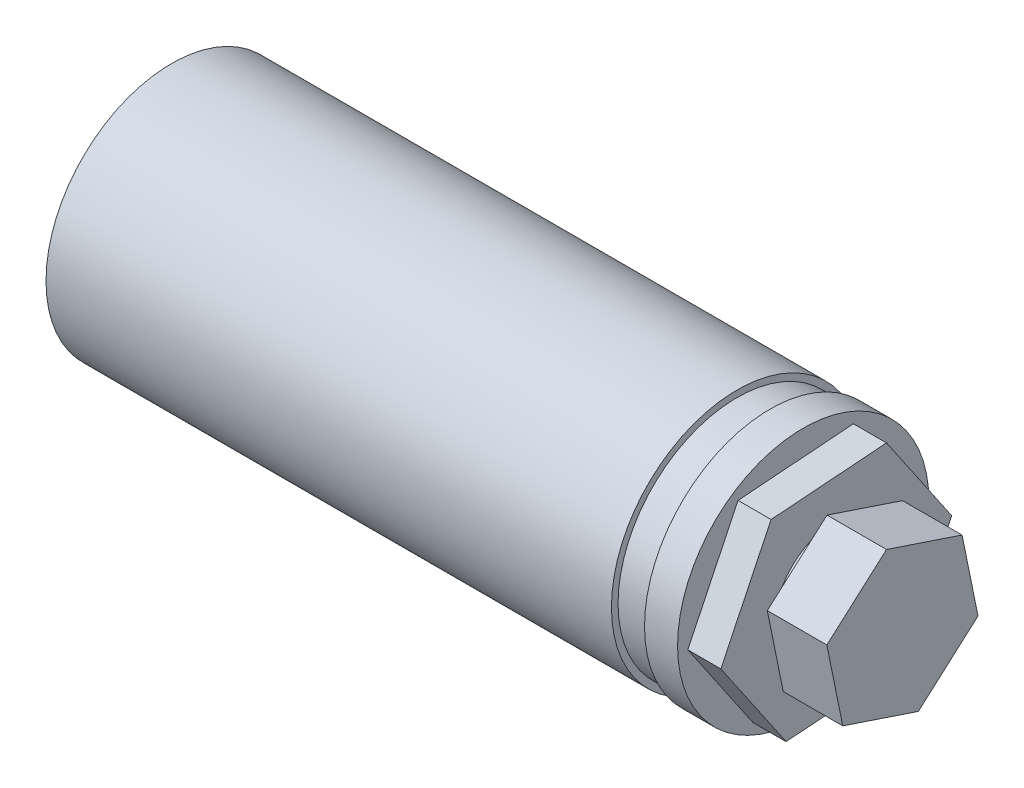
SolidWorks part; units mm, degrees
ref_plane "Alzado" through (0, 0, 0) normal (0, 0, 1) x (1, 0, 0)
ref_plane "Planta" through (0, 0, 0) normal (0, 1, 0) x (1, 0, 0)
ref_plane "Vista lateral" through (0, 0, 0) normal (1, 0, 0) x (0, 0, -1)
sketch "Croquis1" plane through (0, 0, 0) normal (0, 0, 1) x (1, 0, 0)
  line L0 (0, 0) -> (33.7038, 0) construction
  line L1 (0, 0) -> (0, 19)
  line L2 (0, 19) -> (85.5, 19)
  line L3 (85.5, 19) -> (85.5, 18)
  line L4 (85.5, 18) -> (90.5, 18)
  line L5 (90.5, 18) -> (90.5, 19)
  line L6 (90.5, 19) -> (95.5, 19)
  line L7 (95.5, 19) -> (95.5, 0)
  line L8 (95.5, 0) -> (0, 0)
  dimension "D1" = 38
  dimension "D2" = 1
  dimension "D3" = 85.5
  dimension "D4" = 5
revolve "Revolución1" add sketch "Croquis1" angle 360 about L0
sketch "Croquis2" plane through (95.5, 0, 0) normal (1, 0, 0) x (0, 0, -1)
  line L7 (-9.859, 14.4586) -> (-17.451, -1.3089)
  line L8 (-17.451, -1.3089) -> (-7.592, -15.7674)
  line L9 (-7.592, -15.7674) -> (9.859, -14.4586)
  line L10 (9.859, -14.4586) -> (17.451, 1.3089)
  line L11 (17.451, 1.3089) -> (7.592, 15.7674)
  line L12 (7.592, 15.7674) -> (-9.859, 14.4586)
  circle A0 centre (0, 0) radius 15.1554 construction
  dimension "D1" = 35
extrude "Saliente-Extruir1" add sketch "Croquis2" along normal blind 5
sketch "Croquis3" plane through (100.5, 0, 0) normal (1, 0, 0) x (0, 0, -1)
  circle A0 centre (0, 0) radius 9.5
  dimension "D1" = 19
extrude "Saliente-Extruir2" add sketch "Croquis3" along normal blind 1
sketch "Croquis4" plane through (101.5, 0, 0) normal (1, 0, 0) x (0, 0, -1)
  line L1 (-2.407, 11.8071) -> (-11.4288, 3.819)
  line L2 (-11.4288, 3.819) -> (-9.0218, -7.9881)
  line L3 (-9.0218, -7.9881) -> (2.407, -11.8071)
  line L4 (2.407, -11.8071) -> (11.4288, -3.819)
  line L5 (11.4288, -3.819) -> (9.0218, 7.9881)
  line L6 (9.0218, 7.9881) -> (-2.407, 11.8071)
  circle A0 centre (0, 0) radius 10.4356 construction
  dimension "D1" = 24.1
extrude "Saliente-Extruir3" add sketch "Croquis4" along normal blind 9
